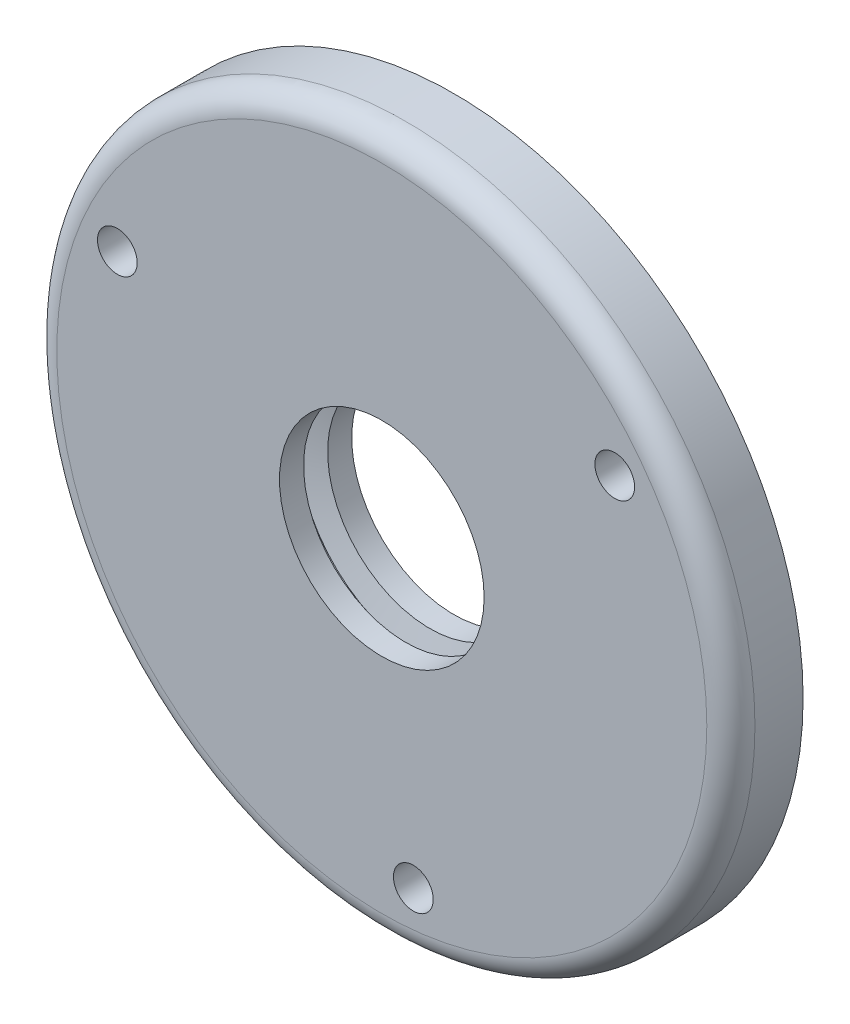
SolidWorks part; units mm, degrees
ref_plane "前视基准面" through (0, 0, 0) normal (0, 0, 1) x (1, 0, 0)
ref_plane "上视基准面" through (0, 0, 0) normal (0, 1, 0) x (1, 0, 0)
ref_plane "右视基准面" through (0, 0, 0) normal (1, 0, 0) x (0, 0, -1)
sketch "草图1" plane through (0, 0, 1.25) normal (0, 0, 1) x (1, 0, 0)
  circle A1 centre (23.1274, 34.5416) radius 8.5 construction
  circle A2 centre (23.1274, 34.5416) radius 15.704
  circle A4 centre (23.1274, 34.5416) radius 20
  dimension "D1" = 31.408
  dimension "D2" = 40
extrude "拉伸1" add sketch "草图1" along normal offset from surface (4.75 mm away) 2
sketch "草图2" plane through (0, 0, 6) normal (0, 0, 1) x (1, 0, 0)
  circle A0 centre (23.1274, 34.5416) radius 8.5
  circle A1 centre (23.1274, 34.5416) radius 29
  circle A2 centre (23.1274, 34.5416) radius 15.704 construction
  dimension "D1" = 17
  dimension "D2" = 58
extrude "拉伸2" add sketch "草图2" along normal blind 6
hole_wizard "M4 螺纹孔1" positions "草图4" profile "草图3" tap size "M4" standard "ISO"
sketch "草图4" plane through (0, 0, 12) normal (0, 0, 1) x (1, 0, 0)
  point P1 (42.4786, 48.7378)
  point P4 (1.1575, 44.2022)
  point P7 (25.746, 10.6849)
sketch "草图3" plane through (42.4786, 48.7378, 12) normal (1, 0, 0) x (0, -1, 0)
  line L0 (0, 0) -> (0, 10.75)
  line L1 (0, 10.75) -> (1.65, 10.75)
  line L2 (1.65, 10.75) -> (1.65, 0)
  line L5 (1.65, 0) -> (0, 0)
  line L11 (0, -6.35) -> (0, 107.95) construction
  dimension "籵謂蹟恇謂郰芛眻噤" = 3.3
  dimension "籵謂蹟恇謂郰芛旮僅" = 10.75
fillet "圆角1" radius 2 1 edges at (52.1274, 34.5416, 12)
ref_plane "基准面1" through (0, 34.5416, 0) normal (0, 1, 0) x (-1, 0, 0)
sketch "草图5" plane through (0, 34.5416, 0) normal (0, 1, 0) x (-1, 0, 0)
  line L0 (-57.1459, 9) -> (10.7893, 9) construction
  line L1 (-23.1274, 12) -> (-23.1274, -6.3102) construction
  line L2 (-14.6274, 12) -> (-31.6274, 12) construction
  line L3 (3.8726, 12) -> (-50.1274, 12) construction
  line L4 (-43.1274, 6) -> (-3.1274, 6) construction
  line L5 (-14.6274, 8) -> (-14.6274, 10)
  line L6 (-14.6274, 10) -> (-12.6274, 9.5)
  line L7 (-12.6274, 9.5) -> (-12.6274, 8.5)
  line L8 (-14.6274, 8) -> (-12.6274, 8.5)
  point P15 (-12.6274, 9)
  point P16 (-14.6274, 9)
  dimension "D1" = 17
  dimension "D2" = 2
  dimension "D3" = 1
  dimension "D4" = 0.5
revolve "切除-旋转1" cut sketch "草图5" angle 360 about L1
